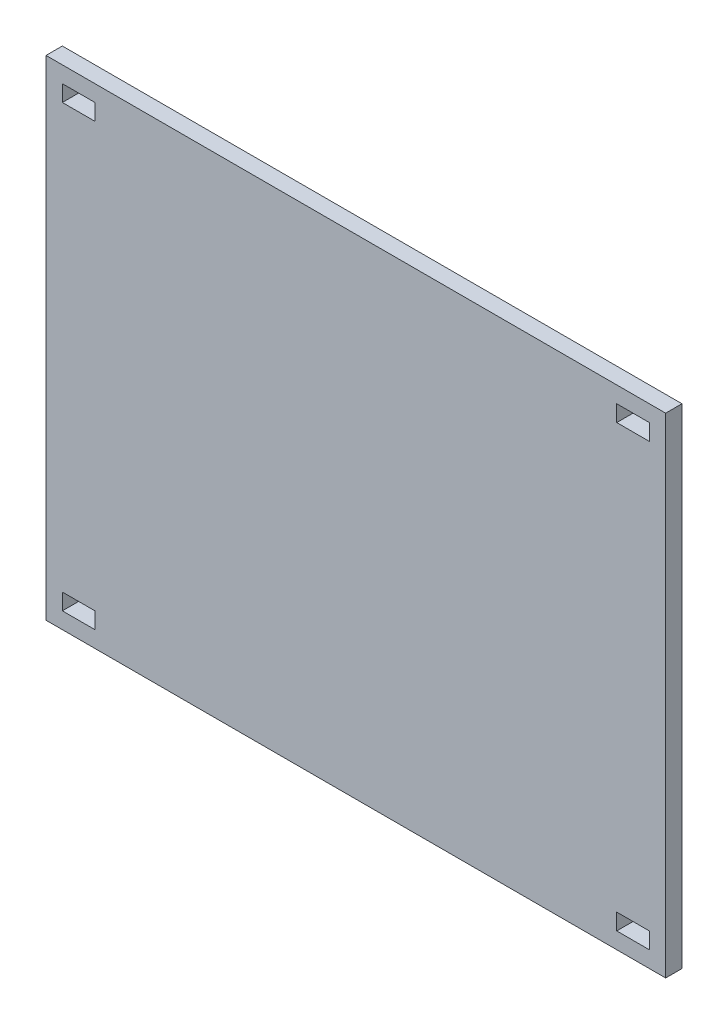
SolidWorks part; units mm, degrees
ref_plane "Front" through (0, 0, 0) normal (0, 0, 1) x (1, 0, 0)
ref_plane "Top" through (0, 0, 0) normal (0, 1, 0) x (1, 0, 0)
ref_plane "Right" through (0, 0, 0) normal (1, 0, 0) x (0, 0, -1)
sketch "Sketch1" plane through (0, 0, 0) normal (0, 0, 1) x (1, 0, 0)
  line L0 (60.325, 95.25) -> (60.325, 0) construction
  line L1 (0, 0) -> (120.65, 0)
  line L2 (0, 0) -> (0, 95.25)
  line L3 (0, 95.25) -> (120.65, 95.25)
  line L4 (120.65, 0) -> (120.65, 95.25)
  line L5 (0, 47.625) -> (120.65, 47.625) construction
  line L6 (9.525, 3.175) -> (9.525, 6.35)
  line L7 (3.175, 92.075) -> (9.525, 92.075)
  line L8 (3.175, 92.075) -> (3.175, 88.9)
  line L9 (3.175, 88.9) -> (9.525, 88.9)
  line L10 (9.525, 92.075) -> (9.525, 88.9)
  line L11 (3.175, 3.175) -> (3.175, 6.35)
  line L12 (3.175, 3.175) -> (9.525, 3.175)
  line L13 (3.175, 6.35) -> (9.525, 6.35)
  line L14 (111.125, 3.175) -> (111.125, 6.35)
  line L15 (117.475, 3.175) -> (111.125, 3.175)
  line L16 (117.475, 3.175) -> (117.475, 6.35)
  line L17 (117.475, 6.35) -> (111.125, 6.35)
  line L18 (117.475, 92.075) -> (117.475, 88.9)
  line L19 (117.475, 92.075) -> (111.125, 92.075)
  line L20 (111.125, 92.075) -> (111.125, 88.9)
  line L21 (117.475, 88.9) -> (111.125, 88.9)
  dimension "D1" = 120.65
  dimension "D2" = 95.25
  dimension "D3" = 6.35
  dimension "D4" = 3.175
  dimension "D5" = 3.175
  dimension "D6" = 3.175
extrude "Boss-Extrude1" add sketch "Sketch1" along normal blind 3.175
